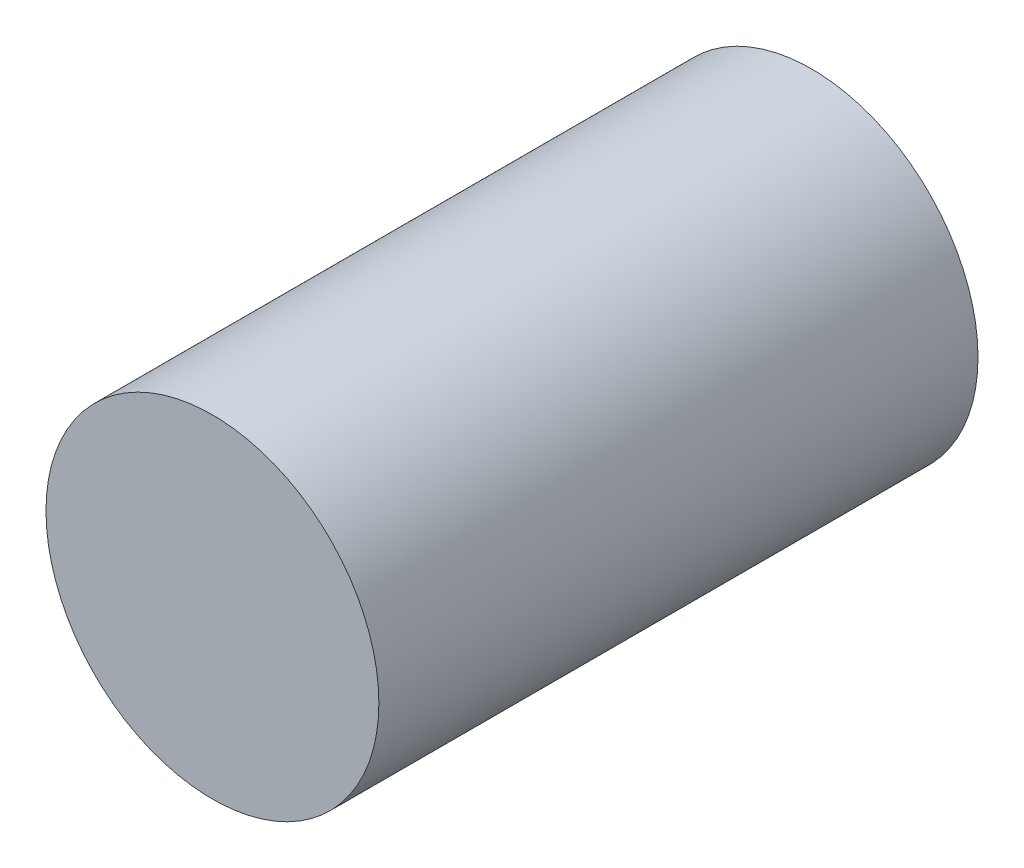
SolidWorks part; units mm, degrees
ref_plane "Front Plane" through (0, 0, 0) normal (1, 0, 0) x (0, 1, 0)
ref_plane "Top Plane" through (0, 0, 0) normal (0, 0, 1) x (0, 1, 0)
ref_plane "Right Plane" through (0, 0, 0) normal (0, 1, 0) x (-1, 0, 0)
sketch "Sketch1" plane through (0, 0, 0) normal (0, 0, 1) x (0, 1, 0)
  circle A0 centre (0, 0) radius 533.4
  dimension "D1" = 1066.8
extrude "Boss-Extrude1" add sketch "Sketch1" along normal blind 1920.24
sketch "Sketch2" plane through (0, 0, 0) normal (0, 0, 1) x (0, 1, 0)
  circle A0 centre (0, 0) radius 381.9962
